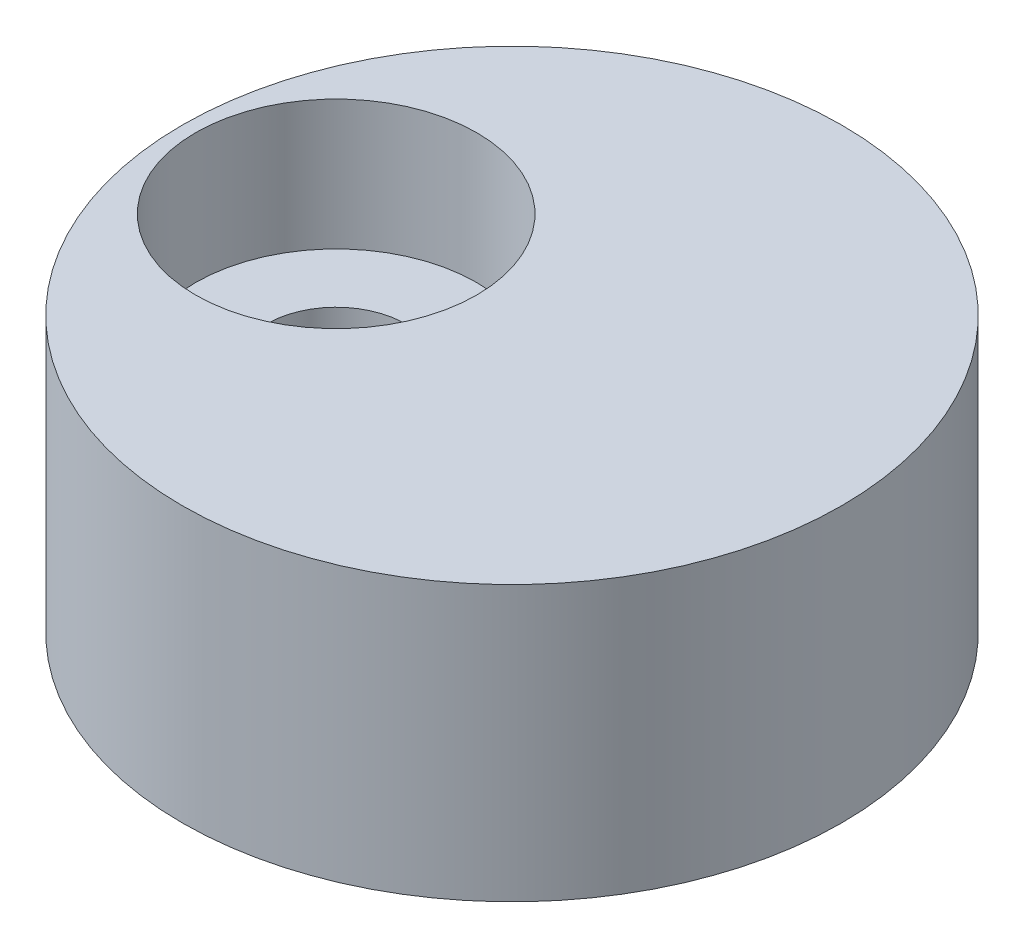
SolidWorks part; units mm, degrees
ref_plane "Front Plane" through (0, 0, 0) normal (0, 0, 1) x (1, 0, 0)
ref_plane "Top Plane" through (0, 0, 0) normal (0, 1, 0) x (1, 0, 0)
ref_plane "Right Plane" through (0, 0, 0) normal (1, 0, 0) x (0, 0, -1)
sketch "Sketch1" plane through (0, 0, 0) normal (0, 1, 0) x (1, 0, 0)
  circle A0 centre (0, 0) radius 7.62
  dimension "D1" = 15.24
extrude "Boss-Extrude1" add sketch "Sketch1" along normal blind 6.35
hole_wizard "CBORE for M3 SHCS1" positions "Sketch4" profile "Sketch5" counterbore size "M3" standard "Ansi Metric"
sketch "Sketch4" plane through (0, 6.35, 0) normal (0, 1, 0) x (-1, 0, 0)
  circle A0 centre (0, 0) radius 7.62 construction
  point P0 (4.064, 0)
  dimension "D1" = 3.556
sketch "Sketch5" plane through (-4.064, 6.35, 0) normal (1, 0, 0) x (0, 0, 1)
  line L0 (0, 0) -> (0, 6.35)
  line L1 (0, 6.35) -> (1.6, 6.35)
  line L3 (1.6, 6.35) -> (1.6, 3)
  line L4 (1.6, 3) -> (3.25, 3)
  line L5 (3.25, 3) -> (3.25, 0)
  line L7 (3.25, 0) -> (0, 0)
  line L11 (0, -6.35) -> (0, 107.95) construction
  dimension "Thru Hole Dia." = 3.2
  dimension "Thru Hole Depth" = 6.35
  dimension "C'Bore Dia." = 6.5
  dimension "C'Bore Depth" = 3
